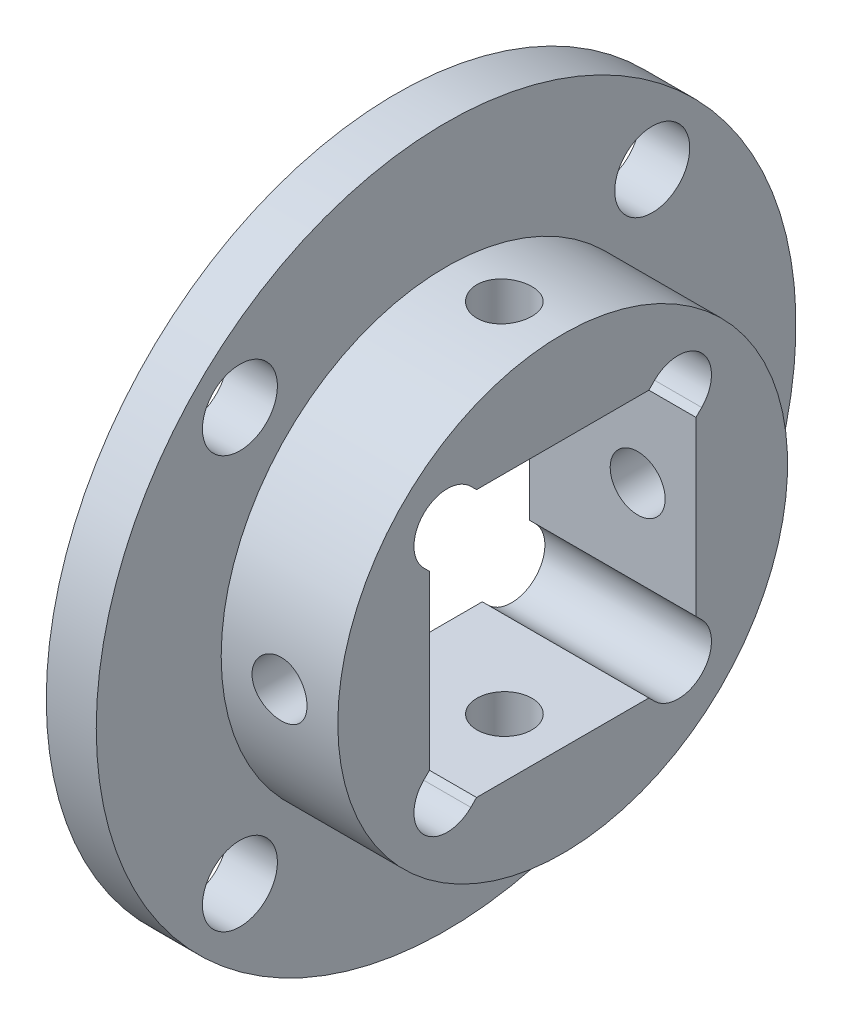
SolidWorks part; units mm, degrees
ref_plane "Plan de face" through (0, 0, 0) normal (0, 0, 1) x (1, 0, 0)
ref_plane "Plan de dessus" through (0, 0, 0) normal (0, 1, 0) x (1, 0, 0)
ref_plane "Plan de droite" through (0, 0, 0) normal (1, 0, 0) x (0, 0, -1)
sketch "Esquisse1" plane through (0, 0, 0) normal (0, 0, 1) x (1, 0, 0)
  line L0 (-19.0972, 0) -> (8.7608, 0) construction
  line L2 (0, 0) -> (10, 0)
  line L3 (0, 0) -> (0, 21)
  line L4 (0, 21) -> (3, 21)
  line L5 (10, 0) -> (10, 13.5)
  line L8 (10, 13.5) -> (3, 13.5)
  line L9 (3, 21) -> (3, 13.5)
  dimension "D1" = 3
  dimension "D2" = 7
  dimension "D3" = 21
  dimension "D4" = 7.5
revolve "Révolution1" add sketch "Esquisse1" angle 360 about L0
sketch "Esquisse2" plane through (10, 0, 0) normal (1, 0, 0) x (0, 0, -1)
  line L0 (-12.3744, 12.3744) -> (0, 0) construction
  line L1 (-8, 8) -> (8, 8)
  line L2 (-8, 8) -> (-8, -8)
  line L3 (-8, -8) -> (8, -8)
  line L4 (8, 8) -> (8, -8)
  line L5 (0, 0) -> (-30.1216, 0) construction
  circle A0 centre (-12.3744, 12.3744) radius 2.25
  circle A1 centre (12.3744, 12.3744) radius 2.25
  circle A2 centre (12.3744, -12.3744) radius 2.25
  circle A3 centre (-12.3744, -12.3744) radius 2.25
  dimension "D6" = 4.5
  dimension "D1" = 16
  dimension "D2" = 16
  dimension "D3" = 8
  dimension "D4" = 8
  dimension "D5" = 17.5
  dimension "D7" = 45
extrude "Enlèv. mat.-Extru.1" cut sketch "Esquisse2" against normal through all
hole_wizard "Trou taraudé M41" positions "Esquisse5" profile "Esquisse4" tap size "M4" standard "ISO"
sketch "Esquisse5" plane through (0, -8, 0) normal (0, 1, 0) x (-1, 0, 0)
  line L0 (-10, 0) -> (-3, 0) construction
  line L1 (-10, 13.5) -> (-10, -13.5) construction
  point P0 (-6.5, 0)
  dimension "D1" = 3.5
sketch "Esquisse4" plane through (6.5, -8, 0) normal (1, 0, 0) x (0, 0, 1)
  line L0 (0, 0) -> (0, 13)
  line L1 (0, 13) -> (1.65, 13)
  line L2 (1.65, 13) -> (1.65, 0)
  line L5 (1.65, 0) -> (0, 0)
  line L11 (0, -6.35) -> (0, 107.95) construction
  dimension "Diamètre du trou pour taraudage jusqu'au prochain" = 3.3
  dimension "Profondeur du trou pour taraudage jusqu'au prochain" = 13
pattern_circular "Répétition circulaire1" count 4 over 360 about axis through (-19.0972, 0, 0) along (-1, 0, 0) of "Trou taraudé M41"
sketch "Esquisse6" [suppressed] plane through (4, 0, 0) normal (1, 0, 0) x (0, 0, -1)
  circle A0 centre (-12.3744, 12.3744) radius 3.5 construction
  dimension "D1" = 7
sketch "Esquisse7" plane through (10, 0, 0) normal (1, 0, 0) x (0, 0, -1)
  line L0 (0, 0) -> (6.9296, 6.9296) construction
  line L1 (8.3439, 5.5154) -> (3.6651, 10.1942) construction
  line L2 (5.5154, 8.3439) -> (5.1716, 8)
  line L3 (8, 8) -> (-8, 8) construction
  line L4 (8.3439, 5.5154) -> (8, 5.1716)
  line L5 (8, -8) -> (8, 8) construction
  line L6 (8, 5.1716) -> (5.1716, 8)
  line L7 (8.3439, -5.5154) -> (8, -5.1716)
  line L8 (5.5154, -8.3439) -> (5.1716, -8)
  line L9 (5.1716, -8) -> (8, -5.1716)
  line L10 (-5.5154, -8.3439) -> (-5.1716, -8)
  line L11 (-8.3439, -5.5154) -> (-8, -5.1716)
  line L12 (-8, -5.1716) -> (-5.1716, -8)
  line L13 (-8.3439, 5.5154) -> (-8, 5.1716)
  line L14 (-5.5154, 8.3439) -> (-5.1716, 8)
  line L15 (-5.1716, 8) -> (-8, 5.1716)
  arc A0 (8.3439, 5.5154) -> (5.5154, 8.3439) centre (6.9296, 6.9296) ccw
  arc A1 (5.5154, -8.3439) -> (8.3439, -5.5154) centre (6.9296, -6.9296) ccw
  arc A2 (-8.3439, -5.5154) -> (-5.5154, -8.3439) centre (-6.9296, -6.9296) ccw
  arc A3 (-5.5154, 8.3439) -> (-8.3439, 5.5154) centre (-6.9296, 6.9296) ccw
  dimension "D2" = 4
  dimension "D1" = 9.8
  dimension "D3" = 4
extrude "Enlèv. mat.-Extru.2" cut sketch "Esquisse7" against normal through all
